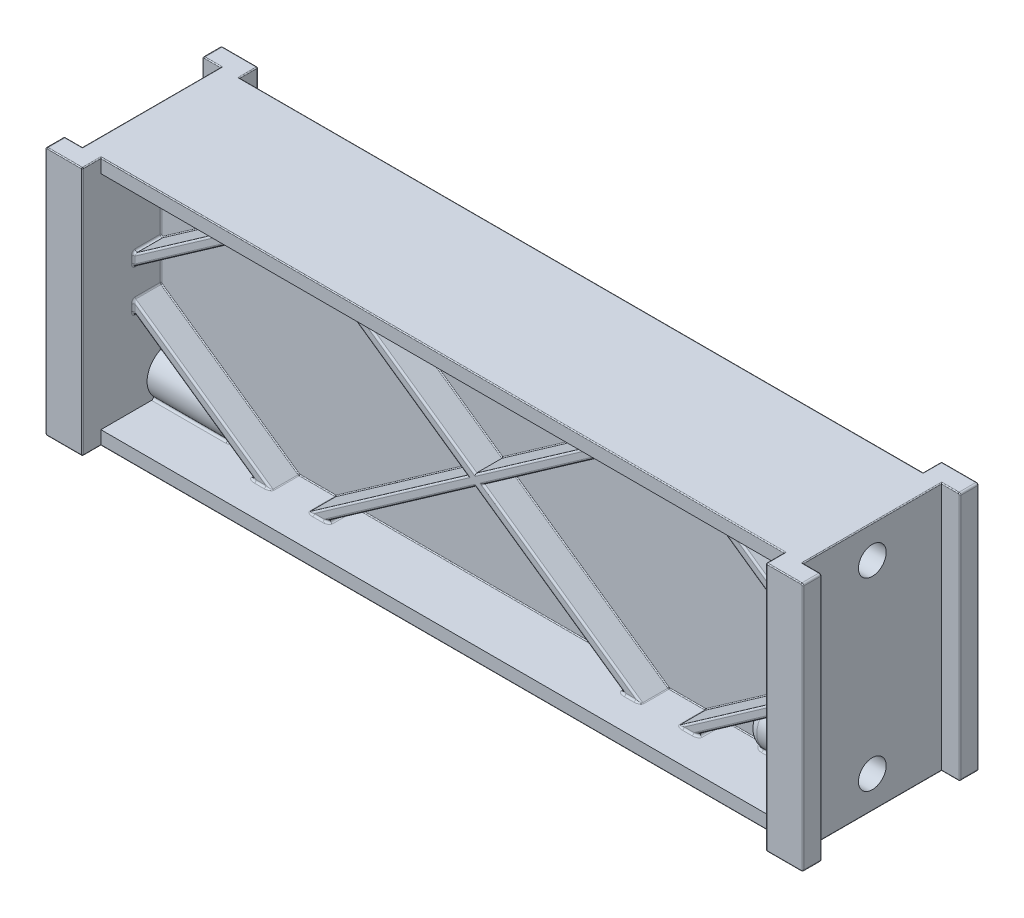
SolidWorks part; units mm, degrees
ref_plane "Face" through (0, 0, 0) normal (0, 0, 1) x (1, 0, 0)
ref_plane "Dessus" through (0, 0, 0) normal (0, 1, 0) x (1, 0, 0)
ref_plane "Droite" through (0, 0, 0) normal (1, 0, 0) x (0, 0, -1)
sketch "Esquisse1" plane through (0, 0, 0) normal (0, 0, 1) x (1, 0, 0)
  line L1 (-41, 13.5) -> (41, 13.5)
  line L2 (-41, 13.5) -> (-41, -13.5)
  line L3 (-41, -13.5) -> (41, -13.5)
  line L4 (41, 13.5) -> (41, -13.5)
  dimension "D1" = 27
  dimension "D2" = 82
  dimension "D3" = 41
  dimension "D4" = 13.5
extrude "Extrusion1" add sketch "Esquisse1" along normal mid plane 19
sketch "Esquisse2" plane through (0, 0, 9.5) normal (0, 0, 1) x (1, 0, 0)
  line L0 (41, -13.5) -> (41, 13.5) construction
  line L1 (-37, 21.1976) -> (37, 21.1976)
  line L2 (-37, 21.1976) -> (-37, -22.598)
  line L3 (-37, -22.598) -> (37, -22.598)
  line L4 (37, 21.1976) -> (37, -22.598)
  line L5 (-41, 13.5) -> (-41, -13.5) construction
  dimension "D1" = 4
  dimension "D2" = 4
extrude "Enlèv. mat.-Extru.1" cut sketch "Esquisse2" against normal blind 2
sketch "Esquisse3" plane through (0, 0, 7.5) normal (0, 0, 1) x (1, 0, 0)
  line L0 (37, -13.5) -> (37, 13.5) construction
  line L1 (-37, 12) -> (37, 12)
  line L2 (-37, 12) -> (-37, -12)
  line L3 (-37, -12) -> (37, -12)
  line L4 (37, 12) -> (37, -12)
  line L5 (37, 13.5) -> (-37, 13.5) construction
  line L6 (-37, -13.5) -> (37, -13.5) construction
  dimension "D1" = 1.5
  dimension "D2" = 1.5
extrude "Enlèv. mat.-Extru.2" cut sketch "Esquisse3" against normal blind 6.5
mirror "Symétrie1" about plane through (0, 0, 0) normal (0, 0, 1)
sketch "Esquisse4" plane through (41, 0, 0) normal (1, 0, 0) x (0, 0, -1)
  line L1 (-7.5, 14.132) -> (7.5, 14.132)
  line L2 (-7.5, 14.132) -> (-7.5, -14.8373)
  line L3 (-7.5, -14.8373) -> (7.5, -14.8373)
  line L4 (7.5, 14.132) -> (7.5, -14.8373)
  dimension "D1" = 7.5
  dimension "D2" = 15
extrude "Enlèv. mat.-Extru.3" cut sketch "Esquisse4" against normal blind 2
mirror "Symétrie2" about plane through (0, 0, 0) normal (1, 0, 0)
sketch "Esquisse5" plane through (39, 0, 0) normal (1, 0, 0) x (0, 0, -1)
  line L0 (0, 0) -> (-16.1392, 0) construction
  line L1 (0, 0) -> (0, 10) construction
  circle A0 centre (0, 10) radius 2.5
  circle A1 centre (0, -10) radius 2.5
  dimension "D1" = 5
  dimension "D2" = 10
extrude "Extrusion2" add sketch "Esquisse5" against normal blind 11
mirror "Symétrie3" about plane through (0, 0, 0) normal (1, 0, 0)
fillet "Congé1" radius 1
sketch "Esquisse6" plane through (39, 0, 0) normal (1, 0, 0) x (0, 0, -1)
  circle A0 centre (0, 10) radius 1.5
  circle A1 centre (0, -10) radius 1.5
  dimension "D1" = 3
  dimension "D2" = 3
extrude "Enlèv. mat.-Extru.4" cut sketch "Esquisse6" against normal blind 10
mirror "Symétrie4" about plane through (0, 0, 0) normal (1, 0, 0)
sketch "Esquisse7" plane through (0, 0, -1) normal (0, 0, -1) x (-1, 0, 0)
  line L0 (0, -17.6328) -> (0, 22.3434) construction
  line L1 (0, 0) -> (-17.1378, 12) construction
  line L2 (-37, 12) -> (37, 12) construction
  line L3 (-22.8812, 12) -> (-37, 2.1139) construction
  line L4 (-37, 13.5) -> (-37, -13.5) construction
  line L6 (-16.2661, 12) -> (0, 0.6104)
  line L7 (-18.0095, 12) -> (0, -0.6104)
  line L8 (0, -0.6104) -> (0, 0.6104)
  line L9 (-16.2661, 12) -> (-18.0095, 12)
  line L10 (-22.0095, 12) -> (-37, 1.5035)
  line L11 (-23.7529, 12) -> (-37, 2.7243)
  line L12 (-22.0095, 12) -> (-23.7529, 12)
  line L13 (-37, 1.5035) -> (-37, 2.7243)
  dimension "D1" = 1
  dimension "D2" = 55
  dimension "D3" = 0.5
  dimension "D4" = 0.5
  dimension "D5" = 55
  dimension "D6" = 1
  dimension "D7" = 4
extrude "Extrusion3" add sketch "Esquisse7" along normal blind 3
mirror "Symétrie5" about plane through (0, 0, 0) normal (0, 1, 0)
mirror "Symétrie6" about plane through (0, 0, 0) normal (1, 0, 0)
mirror "Symétrie7" about plane through (0, 0, 0) normal (0, 0, 1)
fillet "Congé2" radius 0.2
fillet "Congé4" radius 0.1
